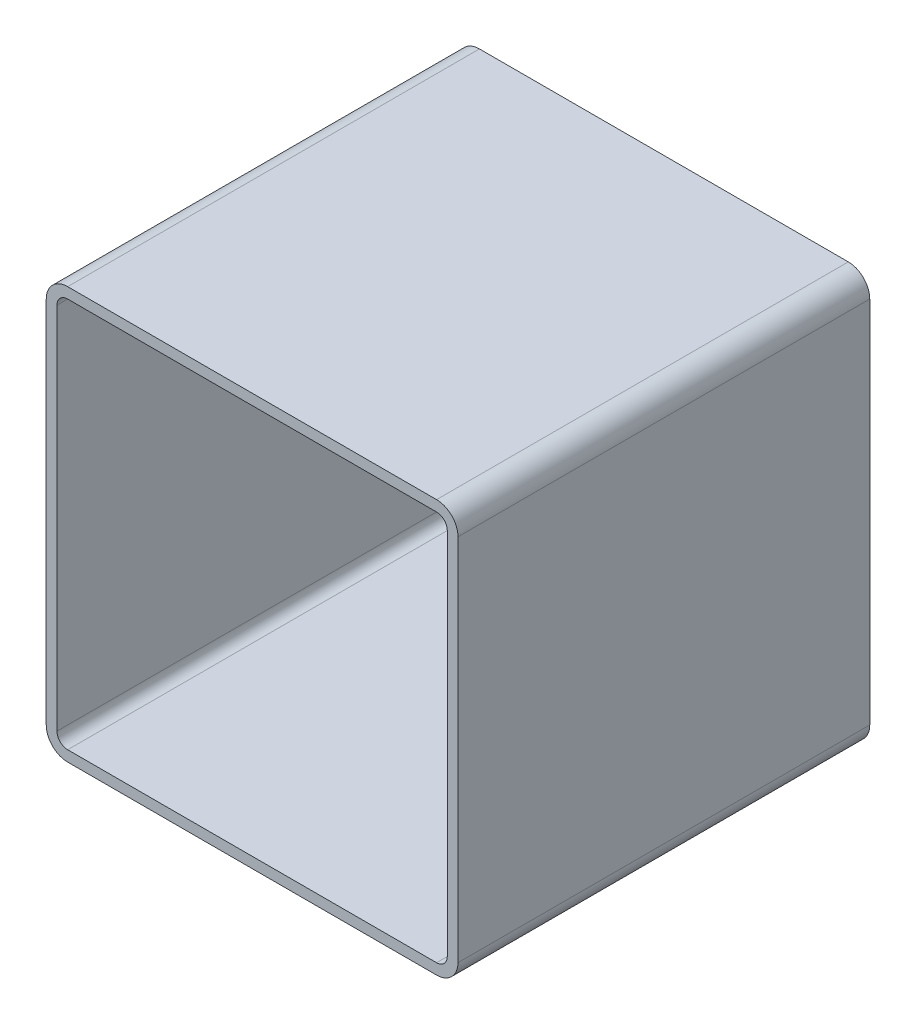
SolidWorks part; units mm, degrees
ref_plane "Front Plane" through (0, 0, 0) normal (0, 0, 1) x (1, 0, 0)
ref_plane "Top Plane" through (0, 0, 0) normal (0, 1, 0) x (1, 0, 0)
ref_plane "Right Plane" through (0, 0, 0) normal (1, 0, 0) x (0, 0, -1)
sketch "Sketch1" plane through (0, 0, 0) normal (0, 0, 1) x (1, 0, 0)
sketch_block_instance "HSS12x12x0.3125-1"
sketch_block "HSS12x12x0.3125"
extrude "Boss-Extrude1" add sketch "Sketch1" along normal blind 304.8
